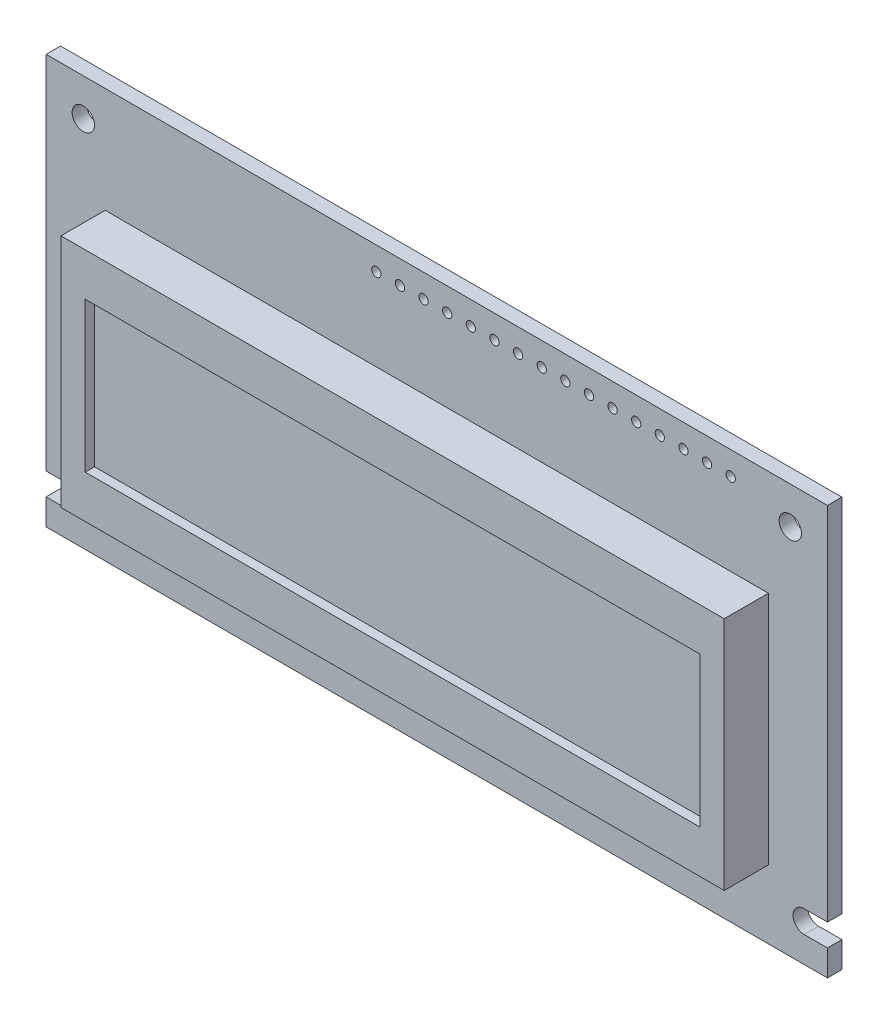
SolidWorks part; units mm, degrees
ref_plane "Plan de face" through (0, 0, 0) normal (0, 0, 1) x (1, 0, 0)
ref_plane "Plan de dessus" through (0, 0, 0) normal (0, 1, 0) x (1, 0, 0)
ref_plane "Plan de droite" through (0, 0, 0) normal (1, 0, 0) x (0, 0, -1)
sketch "Esquisse1" plane through (0, 0, 0) normal (0, 0, 1) x (1, 0, 0)
  line L0 (-56.4282, 29.4905) -> (26.4884, 29.4905) construction
  line L1 (-62.9008, 31.9905) -> (21.0992, 31.9905)
  line L2 (-62.9008, 31.9905) -> (-62.9008, -6.8095)
  line L3 (-62.9008, -12.0095) -> (21.0992, -12.0095)
  line L4 (21.0992, 31.9905) -> (21.0992, -6.8095)
  line L5 (-20.9008, 37.9919) -> (-20.9008, 31.9905) construction
  line L6 (-67.4282, 27.9905) -> (-57.0246, 27.9905) construction
  line L7 (-58.9008, 28.6835) -> (-58.9008, 9.2014) construction
  line L8 (-27.4008, 29.4905) -> (-27.4008, 41.6715) construction
  line L9 (-67.4282, -8.0095) -> (-56.4282, -8.0095) construction
  line L10 (-60.4008, -21.7605) -> (-60.4008, -4.1059) construction
  line L11 (-60.4008, -6.8095) -> (-62.9008, -6.8095)
  line L12 (-60.4008, -9.2095) -> (-62.9008, -9.2095)
  line L13 (-62.9008, -9.2095) -> (-62.9008, -12.0095)
  line L14 (18.5992, -9.2095) -> (21.0992, -9.2095)
  line L15 (18.5992, -6.8095) -> (21.0992, -6.8095)
  line L16 (21.0992, -9.2095) -> (21.0992, -12.0095)
  circle A0 centre (-58.9008, 27.9905) radius 1.2
  arc A1 (-60.4008, -9.2095) -> (-60.4008, -6.8095) centre (-60.4008, -8.0095) ccw
  arc A2 (18.5992, -9.2095) -> (18.5992, -6.8095) centre (18.5992, -8.0095) cw
  circle A3 centre (17.0992, 27.9905) radius 1.2
  circle A4 centre (-27.4008, 29.4905) radius 0.5
  circle A5 centre (-24.8608, 29.4905) radius 0.5
  circle A6 centre (-22.3208, 29.4905) radius 0.5
  circle A7 centre (-19.7808, 29.4905) radius 0.5
  circle A8 centre (-17.2408, 29.4905) radius 0.5
  circle A9 centre (-14.7008, 29.4905) radius 0.5
  circle A10 centre (-12.1608, 29.4905) radius 0.5
  circle A11 centre (-9.6208, 29.4905) radius 0.5
  circle A12 centre (-7.0808, 29.4905) radius 0.5
  circle A13 centre (-4.5408, 29.4905) radius 0.5
  circle A14 centre (-2.0008, 29.4905) radius 0.5
  circle A15 centre (0.5392, 29.4905) radius 0.5
  circle A16 centre (3.0792, 29.4905) radius 0.5
  circle A17 centre (5.6192, 29.4905) radius 0.5
  circle A18 centre (8.1592, 29.4905) radius 0.5
  circle A19 centre (10.6992, 29.4905) radius 0.5
  dimension "D5" = 4
  dimension "D6" = 16
  dimension "D7" = 35.5
  dimension "D8" = 4
  dimension "D1" = 84
  dimension "D2" = 44
  dimension "D3" = 4
  dimension "D4" = 2.5
  dimension "D9" = 2.5
extrude "Boss.-Extru.1" add sketch "Esquisse1" along normal blind 1.55
sketch "Esquisse2" plane through (0, 0, 1.55) normal (0, 0, 1) x (1, 0, 0)
  line L0 (-20.9008, -23.3582) -> (-20.9008, 20.6405) construction
  line L1 (-56.5508, 20.6405) -> (14.7492, 20.6405)
  line L2 (-56.5508, 20.6405) -> (-56.5508, -4.6595)
  line L3 (-56.5508, -4.6595) -> (14.7492, -4.6595)
  line L4 (14.7492, 20.6405) -> (14.7492, -4.6595)
  line L5 (35.3888, 31.9905) -> (-31.2584, 31.9905) construction
  line L6 (21.0992, 31.9905) -> (-62.9008, 31.9905) construction
  line L8 (35.3888, 7.9905) -> (-28.387, 7.9905) construction
  line L9 (21.0992, -6.8095) -> (21.0992, 31.9905) construction
  dimension "D1" = 71.3
  dimension "D2" = 25.3
  dimension "D3" = 12.65
  dimension "D4" = 24
  dimension "D5" = 42
extrude "Boss.-Extru.2" add sketch "Esquisse2" along normal blind 4.75
sketch "Esquisse5" plane through (0, 0, 6.3) normal (0, 0, 1) x (1, 0, 0)
  line L1 (-56.5508, -4.6595) -> (14.7492, 20.6405) construction
  line L2 (-56.5508, 20.6405) -> (14.7492, -4.6595) construction
  line L3 (-56.5508, -4.6595) -> (14.7492, -4.6595) construction
  line L4 (-53.9508, 16.0405) -> (12.1492, 16.0405)
  line L6 (-53.9508, 16.0405) -> (-53.9508, -0.0595)
  line L7 (-53.9508, -0.0595) -> (12.1492, -0.0595)
  line L8 (12.1492, 16.0405) -> (12.1492, -0.0595)
  line L9 (-53.9508, 16.0405) -> (12.1492, -0.0595) construction
  line L10 (-53.9508, -0.0595) -> (12.1492, 16.0405) construction
  line L11 (-56.5508, 20.6405) -> (-56.5508, -4.6595) construction
  point P4 (-20.9008, 7.9905)
  dimension "D1" = 4.6
  dimension "D2" = 2.6
extrude "Enlèv. mat.-Extru.2" cut sketch "Esquisse5" against normal blind 1
